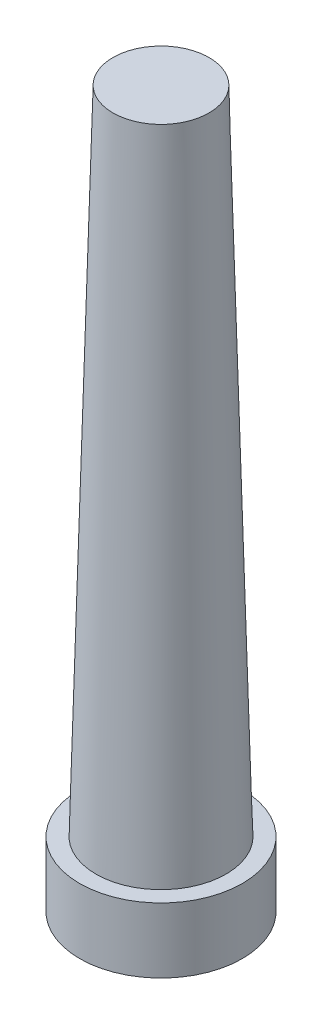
SolidWorks part; units mm, degrees
ref_plane "Front Plane" through (0, 0, 0) normal (0, 0, 1) x (1, 0, 0)
ref_plane "Top Plane" through (0, 0, 0) normal (0, 1, 0) x (1, 0, 0)
ref_plane "Right Plane" through (0, 0, 0) normal (1, 0, 0) x (0, 0, -1)
sketch "Sketch1" plane through (0, 0, 0) normal (0, 1, 0) x (1, 0, 0)
  circle A0 centre (0, 0) radius 125
  dimension "D1" = 250
extrude "Boss-Extrude1" add sketch "Sketch1" along normal blind 100
sketch "Sketch2" plane through (0, 100, 0) normal (0, 1, 0) x (1, 0, 0)
  circle A0 centre (0, 0) radius 100
  dimension "D1" = 200
extrude "Boss-Extrude2" add sketch "Sketch2" along normal blind 1000 draft 1.5
